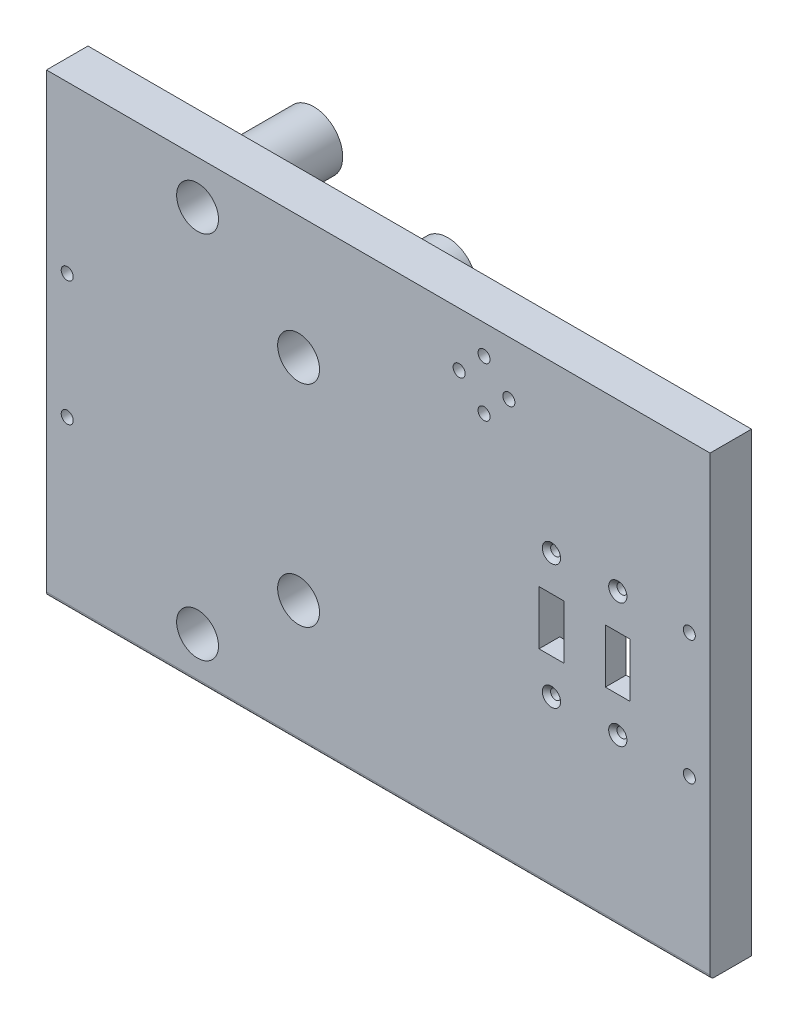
SolidWorks part; units mm, degrees
ref_plane "Front Plane" through (0, 0, 0) normal (0, 0, 1) x (1, 0, 0)
ref_plane "Top Plane" through (0, 0, 0) normal (0, 1, 0) x (1, 0, 0)
ref_plane "Right Plane" through (0, 0, 0) normal (1, 0, 0) x (0, 0, -1)
sketch "Sketch4" plane through (0, 0, 0) normal (0, 0, 1) x (1, 0, 0)
  line L0 (0, 0) -> (97.847, 0) construction
  line L1 (0, 0) -> (0, 72.9027) construction
  line L2 (-76.3384, -41.1169) -> (77.8562, -41.1169) construction
  line L3 (-69.2576, 13.8831) -> (90.7424, 13.8831)
  line L10 (-69.2576, -96.1169) -> (90.7424, -96.1169)
  line L13 (90.7424, 13.8831) -> (90.7424, -96.1169)
  line L14 (-69.2576, 13.8831) -> (-69.2576, -96.1169)
  dimension "D2" = 160
extrude "Boss-Extrude2" add sketch "Sketch4" along normal blind 10
sketch "Sketch5" plane through (0, 0, 10) normal (0, 0, 1) x (1, 0, 0)
  line L0 (-32.8301, -85.6733) -> (-8.4719, -66.4984) construction
  line L1 (-68.4719, -15.7355) -> (-8.4719, -15.7355) construction
  line L2 (29.4981, -41.1169) -> (-84.4045, -41.1169) construction
  line L3 (-32.8301, 3.4395) -> (-8.4719, -15.7355) construction
  line L7 (-68.4719, 13.2645) -> (-68.4719, -15.7355) construction
  circle A2 centre (-8.4719, -15.7355) radius 5.05
  circle A6 centre (-32.8301, 3.4395) radius 5.05
  circle A7 centre (-32.8301, -85.6733) radius 5.05
  circle A8 centre (-8.4719, -66.4984) radius 5.05
  dimension "D1" = 10.1
  dimension "D2" = 60
extrude "Cut-Extrude2" cut sketch "Sketch5" against normal through all
sketch "Sketch6" plane through (0, 0, 10) normal (0, 0, 1) x (1, 0, 0)
fillet "Fillet2" radius 1 1 edges at (10.7424, -96.1169, 10)
sketch "Sketch10" plane through (0, 0, 0) normal (0, 0, -1) x (-1, 0, 0)
  line L1 (-90.7424, -96.1169) -> (-90.7424, 13.8831) construction
  line L2 (-29.4981, -41.1169) -> (72.1964, -41.1169) construction
  line L5 (-90.7424, -96.1169) -> (-90.7424, -83.1169) construction
  line L6 (-36.2424, -5.1169) -> (-36.2424, 6.8831) construction
  line L7 (-30.2424, 0.8831) -> (-90.7424, 0.8831) construction
  circle A4 centre (-36.2424, 6.8831) radius 1.25
  circle A5 centre (-42.2424, 0.8831) radius 1.25
  circle A6 centre (-36.2424, -5.1169) radius 1.25
  circle A7 centre (-30.2424, 0.8831) radius 1.25
  dimension "D1" = 2.5
extrude "Cut-Extrude4" cut sketch "Sketch10" against normal through all
ref_plane "Plane1" through (0, -41.1169, 0) normal (0, 1, 0) x (1, 0, 0)
sketch "Sketch11" plane through (0, 0, 0) normal (0, 0, -1) x (-1, 0, 0)
  line L2 (5.5, -41.1169) -> (-5.5, -41.1169) construction
  line L7 (-86.8663, -41.1169) -> (-37.7625, -41.1169) construction
  line L10 (-71.4981, -23.6169) -> (-49.4981, -23.6169)
  line L11 (-71.4981, -23.6169) -> (-71.4981, -58.6169)
  line L13 (-71.4981, -58.6169) -> (-49.4981, -58.6169)
  line L14 (-49.4981, -23.6169) -> (-49.4981, -58.6169)
  dimension "D1" = 22
  dimension "D2" = 35
extrude "Cut-Extrude5" cut sketch "Sketch11" against normal blind 5
sketch "Sketch12" plane through (0, 0, 5) normal (0, 0, -1) x (-1, 0, 0)
  line L0 (-60.4981, -23.6169) -> (-60.4981, -61.1831) construction
  line L1 (-49.4981, -58.6169) -> (-49.4981, -23.6169) construction
  line L2 (-90.6257, -41.1169) -> (-32.0116, -41.1169) construction
  line L3 (5.5, -41.1169) -> (-5.5, -41.1169) construction
  line L4 (-71.4981, -58.6169) -> (-49.4981, -58.6169) construction
  line L9 (-49.4981, -47.6169) -> (-55.4981, -47.6169)
  line L10 (-55.4981, -34.6169) -> (-55.4981, -47.6169)
  line L11 (-49.4981, -34.6169) -> (-55.4981, -34.6169)
  line L12 (-49.4981, -34.6169) -> (-49.4981, -47.6169)
  line L13 (-49.4981, -23.6169) -> (-71.4981, -23.6169) construction
  line L14 (-71.4981, -34.6169) -> (-71.4981, -47.6169)
  line L15 (-71.4981, -34.6169) -> (-65.4981, -34.6169)
  line L16 (-65.4981, -34.6169) -> (-65.4981, -47.6169)
  line L17 (-71.4981, -47.6169) -> (-65.4981, -47.6169)
  line L18 (-68.4981, -26.1169) -> (-52.4981, -26.1169) construction
  line L19 (-52.4981, -26.1169) -> (-52.4981, -56.1169) construction
  circle A0 centre (-68.4981, -26.1169) radius 0.5
  circle A1 centre (-52.4981, -26.1169) radius 0.5
  circle A2 centre (-52.4981, -56.1169) radius 0.5
  circle A3 centre (-68.4981, -56.1169) radius 0.5
  dimension "D5" = 1
  dimension "D1" = 6
  dimension "D2" = 13
  dimension "D3" = 16
  dimension "D4" = 30
extrude "Cut-Extrude6" cut sketch "Sketch12" against normal through all
sketch "Sketch14" plane through (0, 0, 0) normal (0, 0, -1) x (-1, 0, 0)
  line L0 (89.9787, -41.1169) -> (-128.9244, -41.1169) construction
  line L1 (5.5, -41.1169) -> (-5.5, -41.1169) construction
  line L2 (64.2576, -56.1169) -> (64.2576, -26.1169) construction
  line L4 (-10.7424, -96.1169) -> (-10.7424, 23.2029) construction
  line L5 (-90.7424, -96.1169) -> (69.2576, -96.1169) construction
  line L7 (-85.7424, -56.1169) -> (-85.7424, -26.1169) construction
  circle A2 centre (64.2576, -26.1169) radius 1.45
  circle A3 centre (64.2576, -56.1169) radius 1.45
  circle A4 centre (-85.7424, -56.1169) radius 1.45
  circle A5 centre (-85.7424, -26.1169) radius 1.45
  point P7 (-76.1424, -41.1169)
  point P12 (64.2576, -41.1169)
  point P20 (-85.7424, -41.1169)
  dimension "D1" = 15
hole_wizard "CSK for M2.5 Countersunk Flat Head Screw1" positions "Sketch28" profile "Sketch18" countersink size "M2.5" standard "ISO"
sketch "Sketch28" plane through (0, 0, 0) normal (0, 0, -1) x (-1, 0, 0)
  point P0 (-42.2424, 0.8831)
  point P3 (-36.2424, -5.1169)
  point P6 (-30.2424, 0.8831)
  point P9 (-36.2424, 6.8831)
sketch "Sketch18" plane through (42.2424, 0.8831, 0) normal (1, 0, 0) x (0, 1, 0)
  line L0 (0, 0) -> (0, 10)
  line L1 (0, 10) -> (1.45, 10)
  line L2 (1.45, 10) -> (1.45, 1.3)
  line L3 (1.45, 1.3) -> (2.75, 0)
  line L5 (2.75, 0) -> (0, 0)
  line L6 (-1.45, 1.3) -> (-2.75, 0) construction
  line L11 (0, -6.35) -> (0, 107.95) construction
  dimension "Thru Hole Dia." = 2.9
  dimension "Thru Hole Depth" = 10
  dimension "Near C'Sink Dia." = 5.5
  dimension "Near C'Sink Angle" = 90
extrude "Cut-Extrude8" cut sketch "Sketch14" against normal through all
sketch "Sketch43" plane through (0, 0, 0) normal (0, 0, -1) x (-1, 0, 0)
  line L0 (5.5, -41.1169) -> (-5.5, -41.1169) construction
  circle A0 centre (8.4719, -15.7355) radius 7
  circle A1 centre (32.8301, 3.4395) radius 7
  circle A2 centre (8.4719, -15.7355) radius 5.05
  circle A3 centre (32.8301, 3.4395) radius 5.05
  circle A4 centre (8.4719, -66.4984) radius 5.05
  circle A5 centre (8.4719, -66.4984) radius 7
  circle A6 centre (32.8301, -85.6733) radius 7
  circle A7 centre (32.8301, -85.6733) radius 5.05
  dimension "D1" = 10.1
  dimension "D2" = 14
extrude "Boss-Extrude3" add sketch "Sketch43" along normal blind 18
sketch "Sketch44" plane through (0, 0, 0) normal (0, 0, -1) x (-1, 0, 0)
  line L0 (5.5, -41.1169) -> (-5.5, -41.1169) construction
  circle A0 centre (8.4719, -15.7355) radius 5.05
  circle A1 centre (8.4719, -15.7355) radius 7
  circle A2 centre (8.4719, -66.4984) radius 5.05
  circle A3 centre (8.4719, -66.4984) radius 7
sketch "Sketch45" plane through (0, 0, -18) normal (0, 0, -1) x (-1, 0, 0)
  line L0 (5.5, -41.1169) -> (-5.5, -41.1169) construction
  circle A0 centre (8.4719, -15.7355) radius 7
  circle A1 centre (8.4719, -15.7355) radius 5.05
  circle A6 centre (8.4719, -66.4984) radius 5.05
  circle A7 centre (8.4719, -66.4984) radius 7
extrude "Boss-Extrude5" add sketch "Sketch45" along normal blind 8
hole_wizard "CSK for M2 Countersunk Flat Head Screw2" positions "Sketch50" profile "Sketch49" countersink size "M2" standard "ISO"
sketch "Sketch50" plane through (0, 0, 10) normal (0, 0, 1) x (1, 0, 0)
  point P0 (52.4981, -26.1169)
  point P3 (68.4981, -26.1169)
  point P6 (52.4981, -56.1169)
  point P9 (68.4981, -56.1169)
sketch "Sketch49" plane through (52.4981, -26.1169, 10) normal (1, 0, 0) x (0, -1, 0)
  line L0 (0, 0) -> (0, 36)
  line L1 (0, 36) -> (1.2, 36)
  line L2 (1.2, 36) -> (1.2, 1)
  line L3 (1.2, 1) -> (2.2, 0)
  line L5 (2.2, 0) -> (0, 0)
  line L6 (-1.2, 1) -> (-2.2, 0) construction
  line L11 (0, -6.35) -> (0, 107.95) construction
  dimension "Thru Hole Dia." = 2.4
  dimension "Thru Hole Depth" = 36
  dimension "Near C'Sink Dia." = 4.4
  dimension "Near C'Sink Angle" = 90
sketch "Sketch51" plane through (0, 0, 0) normal (0, 0, -1) x (-1, 0, 0)
  line L0 (8.4719, -15.7355) -> (71.5993, -15.7355) construction
  line L1 (9.2576, -14.3433) -> (32.8301, 3.4395) construction
  dimension "D1" = 37.03
